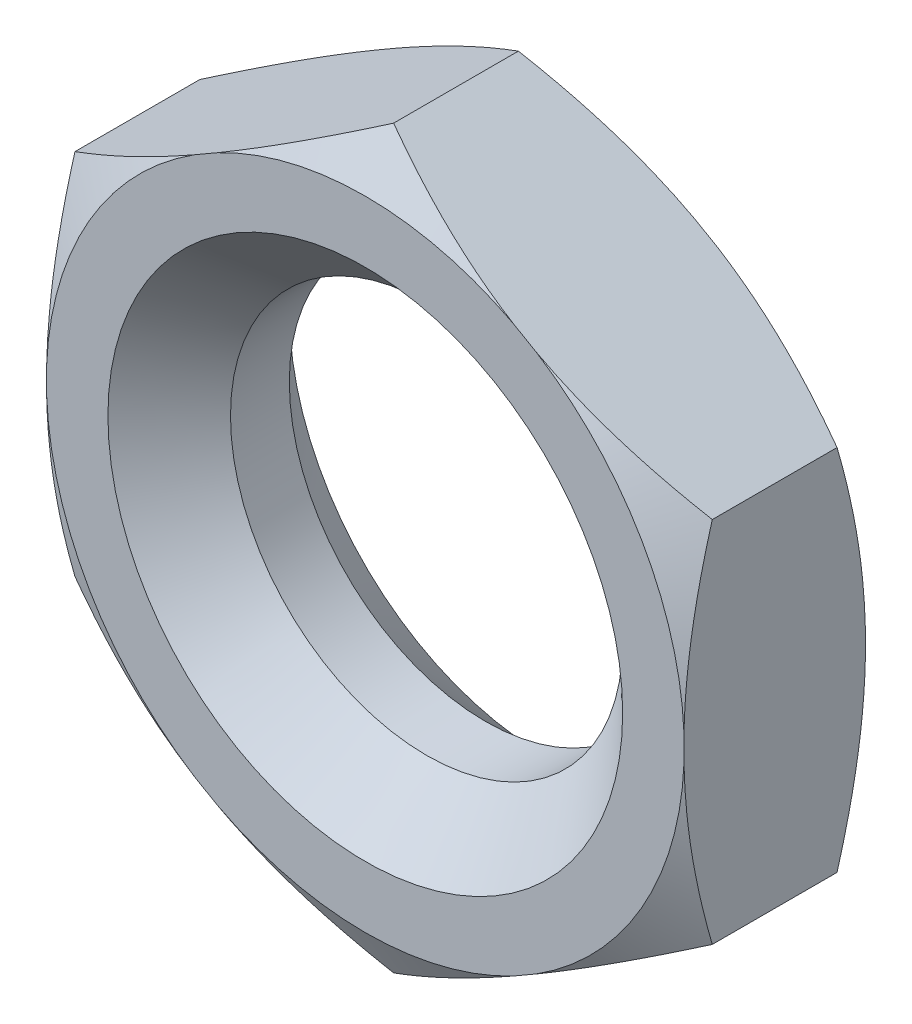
SolidWorks part; units mm, degrees
ref_plane "Front Plane" through (0, 0, 0) normal (0, 0, 1) x (1, 0, 0)
ref_plane "Top Plane" through (0, 0, 0) normal (0, 1, 0) x (1, 0, 0)
ref_plane "Right Plane" through (0, 0, 0) normal (1, 0, 0) x (0, 0, -1)
sketch "Sketch3" plane through (0, 0, 0) normal (0, 0, 1) x (1, 0, 0)
  line L1 (0, 7.5056) -> (-6.5, 3.7528)
  line L2 (-6.5, 3.7528) -> (-6.5, -3.7528)
  line L3 (-6.5, -3.7528) -> (0, -7.5056)
  line L4 (0, -7.5056) -> (6.5, -3.7528)
  line L5 (6.5, -3.7528) -> (6.5, 3.7528)
  line L6 (6.5, 3.7528) -> (0, 7.5056)
  circle A0 centre (0, 0) radius 6.5 construction
  dimension "D1" = 13
extrude "Boss-Extrude1" add sketch "Sketch3" along normal mid plane 3.7
sketch "Sketch4" plane through (0, 0, 0) normal (1, 0, 0) x (0, 0, -1)
  line L0 (-5.4578, 0) -> (6.1545, 0) construction
sketch "Sketch5" plane through (0, 0, 0) normal (1, 0, 0) x (0, 0, -1)
  line L0 (-1.85, 7.5056) -> (-1.85, 6.5056)
  line L1 (-1.85, 3.7528) -> (-1.85, 7.5056) construction
  line L2 (-1.85, 6.5056) -> (-1.2726, 7.5056)
  line L3 (-1.85, 7.5056) -> (1.85, 7.5056) construction
  line L4 (-1.2726, 7.5056) -> (-1.85, 7.5056)
  dimension "D1" = 1
  dimension "D2" = 30
revolve "Cut-Revolve1" cut sketch "Sketch5" angle 360 about L0
mirror "Mirror1" about plane through (0, 0, 0) normal (0, 0, 1) of "Cut-Revolve1"
sketch "Sketch6" plane through (0, 0, 1.85) normal (0, 0, 1) x (1, 0, 0)
  circle A0 centre (0, 0) radius 4
  dimension "D1" = 8
extrude "Cut-Extrude1" cut sketch "Sketch6" against normal blind 3.7
chamfer "Chamfer1" distance 1.25 angle 45 2 edges at (4, 0, -1.85) (4, 0, 1.85)
